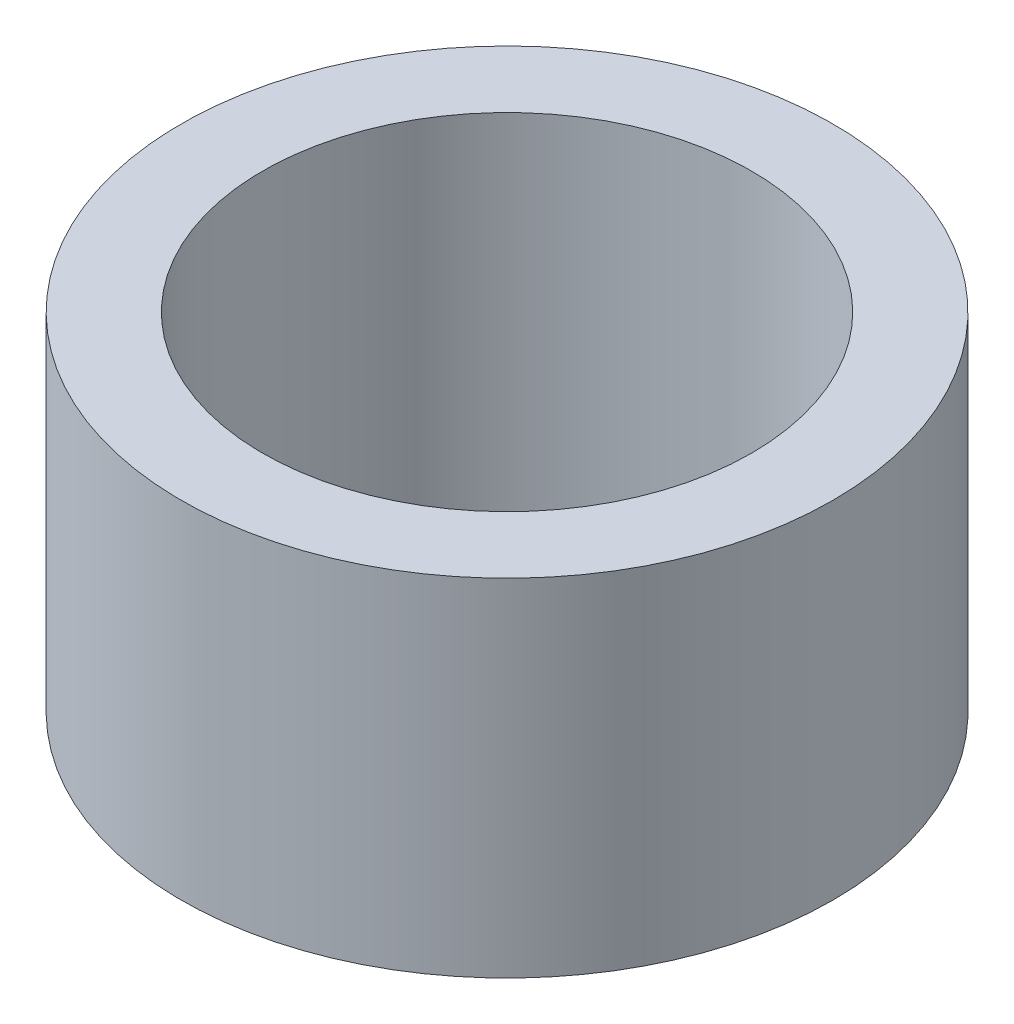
SolidWorks part; units mm, degrees
ref_plane "Plan de face" through (0, 0, 0) normal (0, 0, 1) x (1, 0, 0)
ref_plane "Plan de dessus" through (0, 0, 0) normal (0, 1, 0) x (1, 0, 0)
ref_plane "Plan de droite" through (0, 0, 0) normal (1, 0, 0) x (0, 0, -1)
sketch "Esquisse1" plane through (0, 0, 0) normal (0, 0, 1) x (1, 0, 0)
  line L0 (4, 4.25) -> (3, 4.25)
  line L1 (3, 4.25) -> (3, 0)
  line L2 (3, 0) -> (4, 0)
  line L3 (4, 0) -> (4, 4.25)
  line L4 (0, 4.25) -> (0, 0) construction
revolve "Révolution1" add sketch "Esquisse1" angle 360 about L4
